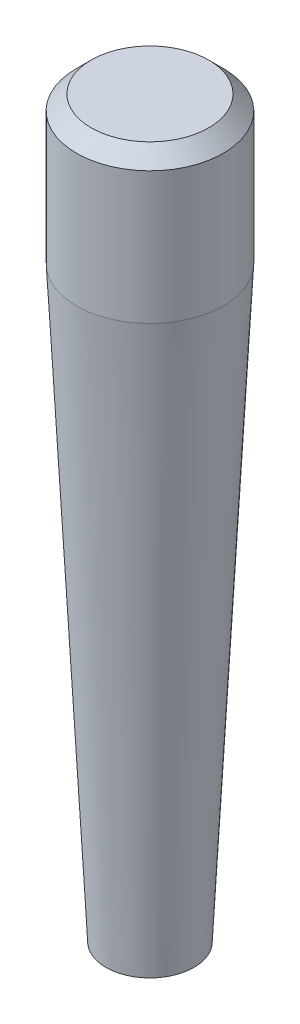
SolidWorks part; units mm, degrees
ref_plane "Front Plane" through (0, 0, 0) normal (0, 0, 1) x (1, 0, 0)
ref_plane "Top Plane" through (0, 0, 0) normal (0, 1, 0) x (1, 0, 0)
ref_plane "Right Plane" through (0, 0, 0) normal (1, 0, 0) x (0, 0, -1)
sketch "Sketch1" plane through (0, 0, 0) normal (0, 0, 1) x (1, 0, 0)
  line L0 (0, 0) -> (0, -50)
  line L1 (0, -50) -> (-3, -50)
  line L2 (-3, -50) -> (-5, -10)
  line L3 (-5, -10) -> (-5, 0)
  line L4 (-5, 0) -> (0, 0)
  dimension "D1" = 5
  dimension "D2" = 50
  dimension "D3" = 10
  dimension "D4" = 3
revolve "Revolve1" add sketch "Sketch1" angle 360 about L0
chamfer "Chamfer1" distance 1 angle 45 1 edges at (-5, 0, 0)
